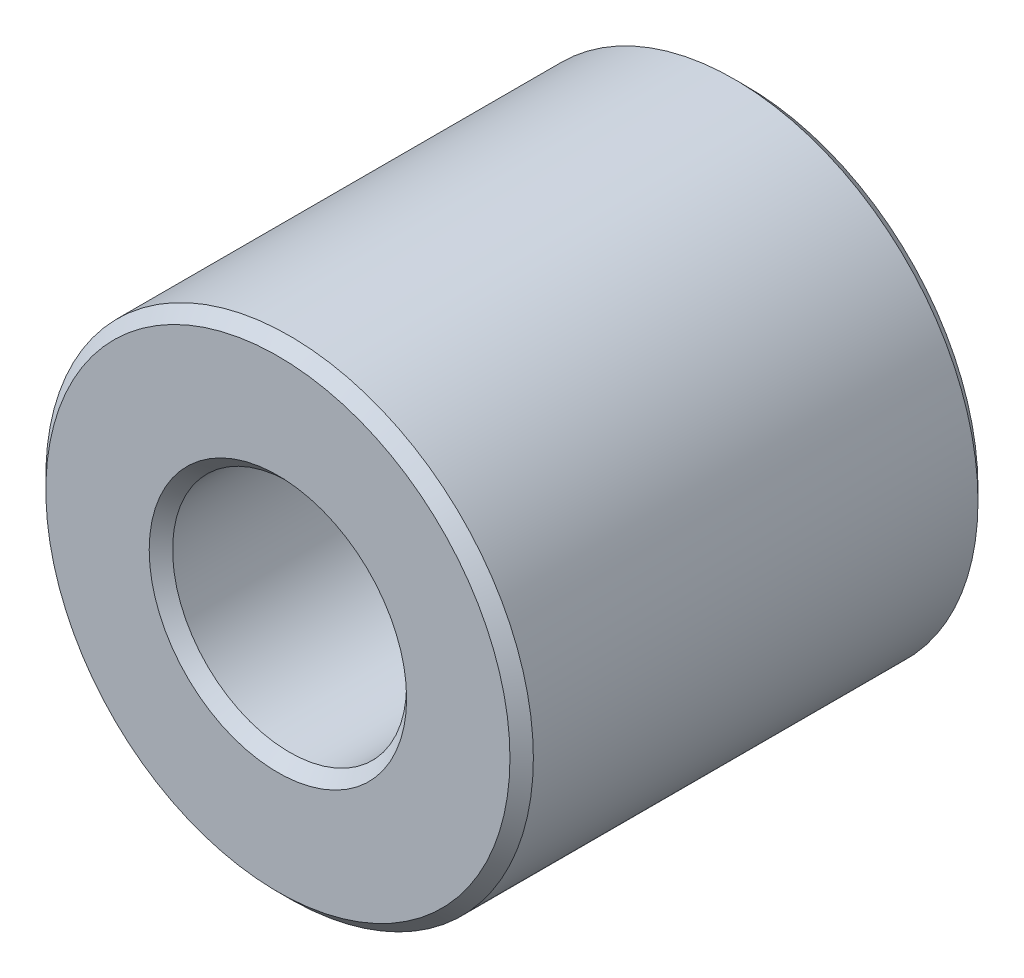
SolidWorks part; units mm, degrees
ref_plane "Front Plane" through (0, 0, 0) normal (0, 0, 1) x (1, 0, 0)
ref_plane "Top Plane" through (0, 0, 0) normal (0, 1, 0) x (1, 0, 0)
ref_plane "Right Plane" through (0, 0, 0) normal (1, 0, 0) x (0, 0, -1)
sketch "Sketch1" plane through (0, 0, 0) normal (0, 0, 1) x (1, 0, 0)
  circle A0 centre (0, 0) radius 18
  circle A1 centre (0, 0) radius 37.5
  dimension "D1" = 36
  dimension "D2" = 75
extrude "Boss-Extrude1" add sketch "Sketch1" along normal mid plane 72
chamfer "Chamfer1" distance 1.8 angle 45 4 edges at (18, 0, -36) (37.5, 0, -36) (18, 0, 36) (37.5, 0, 36)
